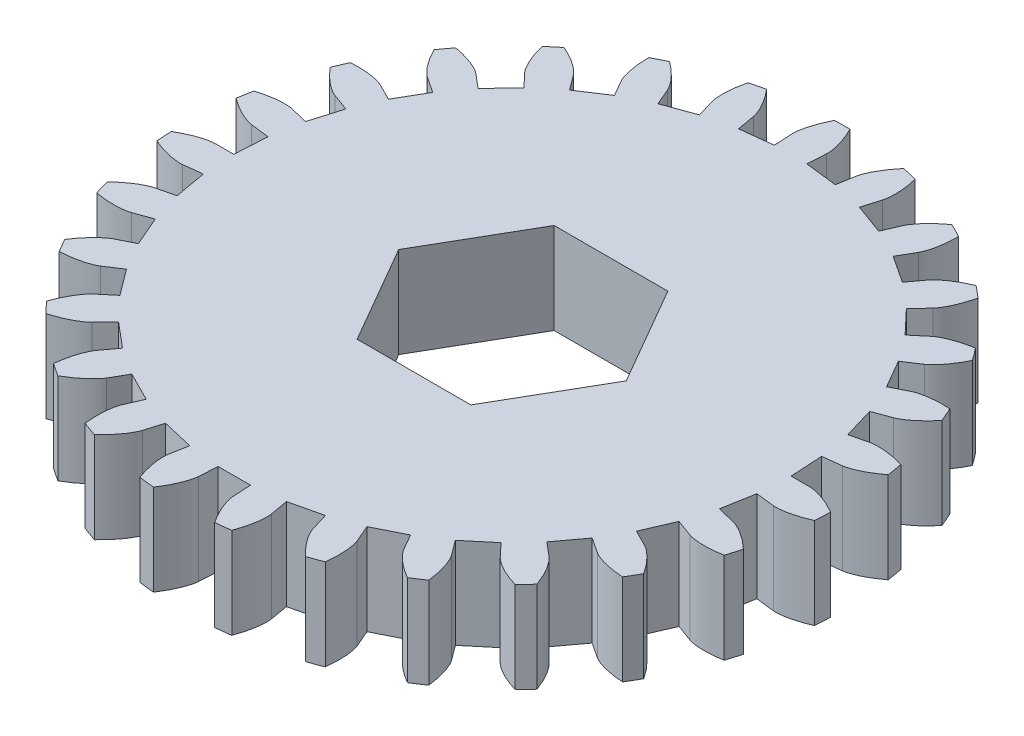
SolidWorks part; units mm, degrees
ref_plane "Front Plane" through (0, 0, 0) normal (0, 0, 1) x (1, 0, 0)
ref_plane "Top Plane" through (0, 0, 0) normal (0, 1, 0) x (1, 0, 0)
ref_plane "Right Plane" through (0, 0, 0) normal (1, 0, 0) x (0, 0, -1)
sketch "Sketch1" plane through (0, 0, 0) normal (0, 1, 0) x (1, 0, 0)
  line L0 (0, 0) -> (0, 3.2675) construction
  line L1 (0, 0) -> (-3.2675, 0) construction
  line L2 (0, 0) -> (-3.6189, -0.2108) construction
  line L3 (0, 0) -> (-3.2454, -0.3793) construction
  line L4 (0, 0) -> (-3.1794, -0.7535) construction
  circle A0 centre (0, 0) radius 3.375 construction
  circle A1 centre (0, 0) radius 3.2675 construction
  circle A2 centre (0, 0) radius 3.0625 construction
  circle A3 centre (0, 0) radius 3.625 construction
  spline S0 degree 4 poles (-3.2675, 0) (-3.2719, 0) (-3.2843, -0.0005) (-3.3076, -0.0031) (-3.3453, -0.01) (-3.3926, -0.0224) (-3.4526, -0.0425) (-3.5215, -0.0715) (-3.595, -0.1087) (-3.6722, -0.1547) (-3.7464, -0.2054) (-3.8178, -0.2602) (-3.8861, -0.3186) (-3.9656, -0.3935) (-4.0559, -0.489) (-4.1538, -0.6085) (-4.2553, -0.7525) (-4.3479, -0.9076) (-4.4297, -1.0666) (-4.5013, -1.2336) (-4.5625, -1.3996) (-4.6142, -1.577) (-4.6558, -1.7435) (-4.6888, -1.9343) (-4.7114, -2.0896) (-4.7266, -2.2977) (-4.7311, -2.4215) (-4.7313, -2.5671) (-4.7287, -2.6321) (-4.7271, -2.6721) knots 0 0 0 0 0 0.005377 0.015084 0.028532 0.04661 0.064855 0.092111 0.119476 0.146842 0.174209 0.201575 0.228941 0.256307 0.307035 0.361767 0.4165 0.471232 0.525964 0.580697 0.635429 0.690161 0.744894 0.799626 0.854358 0.909091 0.954545 1 1 1 1 1 construction
  spline S1 degree 4 poles (-3.2675, 0) (-3.2719, 0) (-3.2843, -0.0005) (-3.3076, -0.0031) (-3.3453, -0.01) (-3.3926, -0.0224) (-3.4526, -0.0425) (-3.5215, -0.0715) (-3.595, -0.1087) (-3.6722, -0.1547) (-3.7464, -0.2054) (-3.8178, -0.2602) (-3.8861, -0.3186) (-3.9656, -0.3935) (-4.0559, -0.489) (-4.1538, -0.6085) (-4.2553, -0.7525) (-4.3479, -0.9076) (-4.4297, -1.0666) (-4.5013, -1.2336) (-4.5625, -1.3996) (-4.6142, -1.577) (-4.6558, -1.7435) (-4.6888, -1.9343) (-4.7114, -2.0896) (-4.7233, -2.2526) (-4.7274, -2.3323) (-4.7287, -2.3731) knots 0 0 0 0 0 0.005377 0.015084 0.028532 0.04661 0.064855 0.092111 0.119476 0.146842 0.174209 0.201575 0.228941 0.256307 0.307035 0.361767 0.4165 0.471232 0.525964 0.580697 0.635429 0.690161 0.744894 0.799626 0.854358 0.909091 0.909091 0.909091 0.909091 0.909091
  dimension "D1" = 7.25
  dimension "D2" = 6.75
  dimension "D3" = 6.535
  dimension "D4" = 6.125
  dimension "D5" = 3.2675
  dimension "D6" = 3.333
  dimension "D7" = 6.667
  dimension "D8" = 13.333
sketch "Sketch2" plane through (0, 0, 0) normal (0, 1, 0) x (1, 0, 0)
  line L0 (0, 0) -> (-3.6189, -0.2108) construction
  line L1 (0, 0) -> (-3.6189, -0.2108) construction
  line L2 (0, 0) -> (-3.2454, -0.3793) construction
  line L3 (0, 0) -> (-3.2675, 0) construction
  line L4 (0, 0) -> (-3.1794, -0.7535) construction
  line L5 (0, 0) -> (-3.2454, -0.3793) construction
  line L6 (0, 0) -> (-3.2675, 0) construction
  line L7 (0, 0) -> (-3.1794, -0.7535) construction
  line L8 (-3.2454, -0.3793) -> (-3.0418, -0.3555)
  line L9 (-3.0418, -0.3555) -> (-2.9799, -0.7063)
  line L10 (-2.9799, -0.7063) -> (-3.1794, -0.7535) construction
  line L11 (-2.9799, -0.7063) -> (-0.4865, -0.1153)
  line L12 (-3.2675, 0) -> (-0.5, 0)
  circle A0 centre (0, 0) radius 3.0625 construction
  circle A1 centre (0, 0) radius 3.2675 construction
  circle A2 centre (0, 0) radius 3.375 construction
  circle A3 centre (0, 0) radius 3.625 construction
  circle A4 centre (0, 0) radius 3.0625 construction
  circle A5 centre (0, 0) radius 3.2675 construction
  circle A6 centre (0, 0) radius 3.375 construction
  circle A7 centre (0, 0) radius 3.625 construction
  arc A8 (-3.6129, -0.2955) -> (-3.6228, -0.126) centre (0, 0) cw
  circle A11 centre (0, 0) radius 0.5 construction
  arc A12 (-0.5, 0) -> (-0.4865, -0.1153) centre (0, 0) ccw
  spline S0 degree 4 poles (-35.0993, -999.4915) (-2.47, -16.2177) (-2.4862, -0.3012) (-2.9436, 0.0631) (-3.3453, -0.01) (-3.3926, -0.0224) (-3.4526, -0.0425) (-3.5215, -0.0715) (-3.595, -0.1087) (-3.6722, -0.1547) (-3.7464, -0.2054) (-3.8178, -0.2602) (-3.8861, -0.3186) (-3.9656, -0.3935) (-4.0559, -0.489) (-4.1538, -0.6085) (-4.2553, -0.7525) (-4.3479, -0.9076) (-4.4297, -1.0666) (-4.5013, -1.2336) (-4.5625, -1.3996) (-4.6142, -1.577) (-4.6558, -1.7435) (-4.6888, -1.9343) (-4.8001, -2.6975) (-4.7076, -5.2209) (-3.3656, 24.9574) (-37.0828, -1001.8432) knots -0.45029 -0.45029 -0.45029 -0.45029 -0.45029 0.005377 0.015084 0.028532 0.04661 0.064855 0.092111 0.119476 0.146842 0.174209 0.201575 0.228941 0.256307 0.307035 0.361767 0.4165 0.471232 0.525964 0.580697 0.635429 0.690161 0.744894 0.799626 0.854358 1.765945 1.765945 1.765945 1.765945 1.765945 only from (-3.2675, 0) to (-4.7287, -2.3731) construction
  spline S1 degree 4 poles (-3.2675, 0) (-3.2719, 0) (-3.2843, -0.0005) (-3.3076, -0.0031) (-3.3453, -0.01) (-3.3926, -0.0224) (-3.4526, -0.0425) (-3.5187, -0.0703) (-3.5695, -0.0958) (-3.606, -0.1162) (-3.6228, -0.126) knots 0 0 0 0 0 0.005377 0.015084 0.028532 0.04661 0.064855 0.092111 0.115778 0.115778 0.115778 0.115778 0.115778
  spline S2 degree 4 poles (-3.2454, -0.3793) (-3.2498, -0.3798) (-3.2621, -0.3808) (-3.2856, -0.3809) (-3.3238, -0.3785) (-3.3722, -0.3716) (-3.4342, -0.3586) (-3.503, -0.3386) (-3.5565, -0.3192) (-3.5951, -0.3032) (-3.6129, -0.2955) knots 0 0 0 0 0 0.005377 0.015084 0.028532 0.04661 0.064855 0.092111 0.115778 0.115778 0.115778 0.115778 0.115778
  point P21 (-3.0418, -0.3555)
  point P24 (-2.9799, -0.7063)
  dimension "D2" = 1
extrude "Boss-Extrude1" add sketch "Sketch2" along normal blind 1
pattern_circular "CirPattern1" count 27 over 360 of "Boss-Extrude1"
sketch "Sketch3" plane through (0, 1, 0) normal (0, 1, 0) x (1, 0, 0)
  line L1 (-0.3536, -0.3536) -> (0.3536, -0.3536)
  line L2 (-0.3536, -0.3536) -> (-0.3536, 0.3536)
  line L3 (-0.3536, 0.3536) -> (0.3536, 0.3536)
  line L4 (0.3536, -0.3536) -> (0.3536, 0.3536)
  line L5 (-0.3536, -0.3536) -> (0.3536, 0.3536) construction
  line L6 (-0.3536, 0.3536) -> (0.3536, -0.3536) construction
  circle A0 centre (0, 0) radius 0.5 construction
  circle A1 centre (0, 0) radius 0.5
  point P0 (0, 0)
extrude "Boss-Extrude2" add sketch "Sketch3" against normal blind 1 contours L2 A1 | L3 A1 | L4 A1 | L1 A1
sketch "Sketch4" plane through (0, 1, 0) normal (0, 1, 0) x (1, 0, 0)
  line L1 (1.25, 0) -> (0.625, 1.0825)
  line L2 (0.625, 1.0825) -> (-0.625, 1.0825)
  line L3 (-0.625, 1.0825) -> (-1.25, 0)
  line L4 (-1.25, 0) -> (-0.625, -1.0825)
  line L5 (-0.625, -1.0825) -> (0.625, -1.0825)
  line L6 (0.625, -1.0825) -> (1.25, 0)
  circle A0 centre (0, 0) radius 1.25 construction
  dimension "D1" = 2.5
extrude "Cut-Extrude1" cut sketch "Sketch4" against normal up to surface (1 mm away)
equation "\"Module\"= .25"
equation "\"Number of Teeth\"= 27"
equation "\"Pressure Angle\"= 14.5deg"
equation "\"Pitch Diameter\"= \"Number of Teeth\" * \"Module\""
equation "\"Circular Pitch\"= pi * \"Module\""
equation "\"Addendum\"= \"Module\""
equation "\"Dedendum\"= 1.25 * \"Module\""
equation "\"Base Diameter\"= \"Pitch Diameter\" * cos ( \"Pressure Angle\" )"
equation "\"Base Radius\"= \"Base Diameter\" / 2"
equation "\"Width\"= 1"
equation "\"Outside Diameter\"= \"Pitch Diameter\" + 2 * \"Addendum\""
equation "\"D1@Sketch1\"=\"Outside Diameter\""
equation "\"D3@Sketch1\"=\"Base Diameter\""
equation "\"Root Diameter\"= \"Pitch Diameter\" - 2 * \"Dedendum\""
equation "\"D4@Sketch1\"=\"Root Diameter\""
equation "\"Tooth Angle\"= 360 / \"Number of Teeth\""
equation "\"D6@Sketch1\"=\"Tooth Angle\"/4"
equation "\"D7@Sketch1\"=\"Tooth Angle\"/2"
equation "\"D8@Sketch1\"=\"Tooth Angle\""
equation "\"D2@Sketch1\" = \"Pitch Diameter\""
equation "\"Shaft Diameter\"= 1"
equation "\"D1@CirPattern1\" = \"Number of Teeth\""
equation "\"D2@Sketch2\"= \"Shaft Diameter\""
equation "\"D1@Boss-Extrude1\" = \"Width\""
